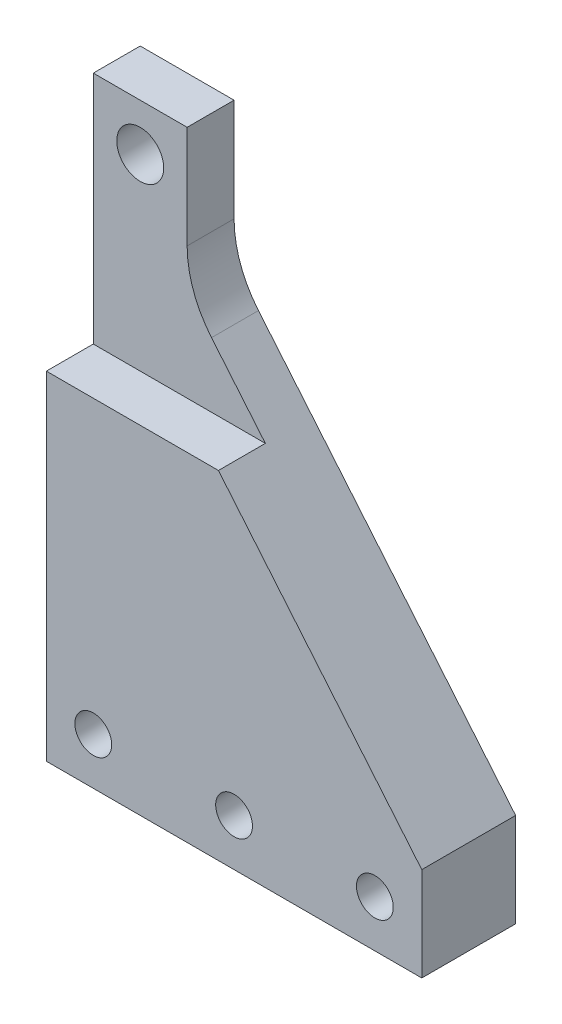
SolidWorks part; units mm, degrees
other "<CylinderPlate>-<Fillet1>"
ref_plane "Front" through (0, 0, 0) normal (0, 0, 1) x (1, 0, 0)
ref_plane "Top" through (0, 0, 0) normal (0, 1, 0) x (1, 0, 0)
ref_plane "Right" through (0, 0, 0) normal (1, 0, 0) x (0, 0, -1)
mirrored part "CylinderPlate_Mirrored"
